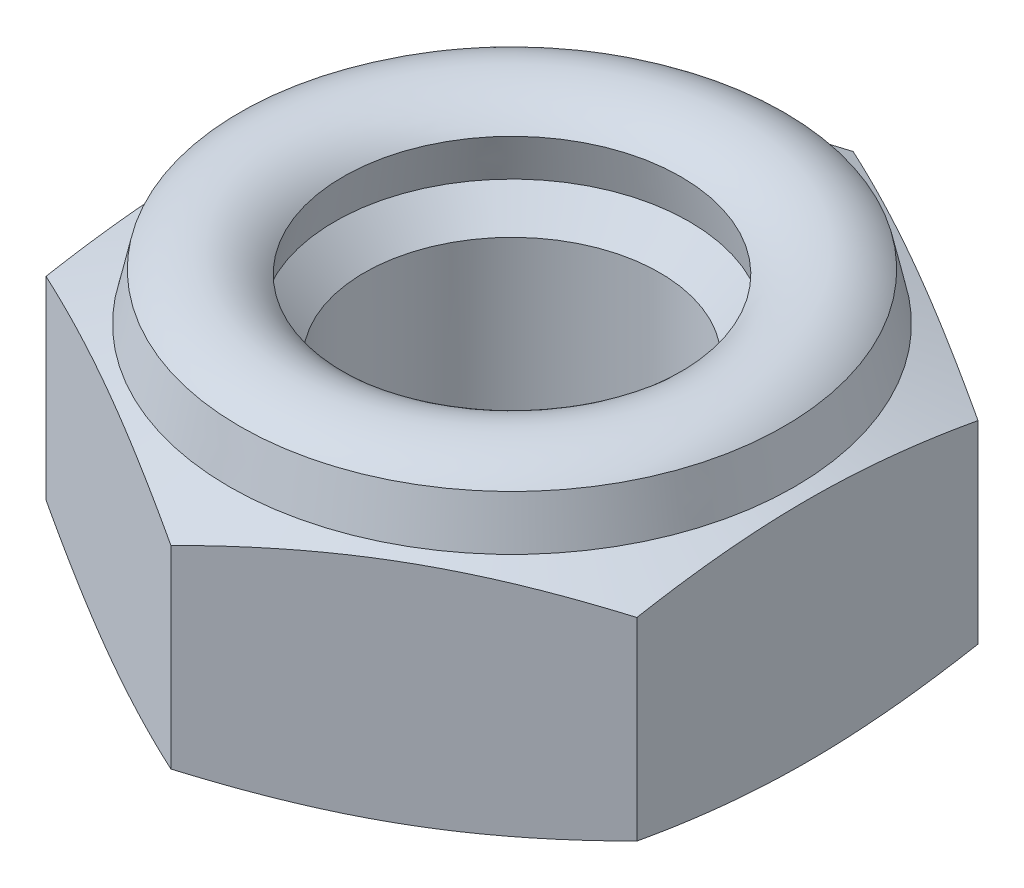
SolidWorks part; units mm, degrees
ref_plane "前视" through (0, 0, 0) normal (0, 0, 1) x (1, 0, 0)
ref_plane "上视" through (0, 0, 0) normal (0, 1, 0) x (1, 0, 0)
ref_plane "右视" through (0, 0, 0) normal (1, 0, 0) x (0, 0, -1)
sketch "草图1" plane through (0, 0, 0) normal (0, 1, 0) x (1, 0, 0)
  line L0 (0, 3.1049) -> (0, -3.4641) construction
  line L1 (0, -2.3094) -> (2, -1.1547)
  line L2 (2, -1.1547) -> (2, 1.1547)
  line L3 (2, 1.1547) -> (0, 2.3094)
  line L4 (0, 2.3094) -> (-2, 1.1547)
  line L5 (-2, 1.1547) -> (-2, -1.1547)
  line L6 (-2, -1.1547) -> (0, -2.3094)
  circle A0 centre (0, 0) radius 2 construction
  dimension "D1" = 4
extrude "拉伸1" add sketch "草图1" along normal blind 1.6
hole_wizard "M2 螺纹孔1" positions "草图3" profile "草图2" tap size "M2" standard "DIN"
sketch "草图3" plane through (0, 1.6, 0) normal (0, 1, 0) x (-1, 0, 0)
  point P0 (0, 0)
sketch "草图2" plane through (0, 1.6, 0) normal (1, 0, 0) x (0, 0, 1)
  line L0 (0, 0) -> (0, 6.4807)
  line L1 (0, 6.4807) -> (0.8, 6)
  line L2 (0.8, 6) -> (0.8, 4)
  line L3 (0.8, 4) -> (1, 4)
  line L4 (1, 4) -> (1, 0)
  line L5 (1, 0) -> (0, 0)
  line L10 (0, 6.4807) -> (-0.8, 6) construction
  line L11 (0, -6.35) -> (0, 107.95) construction
  dimension "蹟恇謂郰芛眻噤" = 1.6
  dimension "蹟恇謂郰芛旮僅" = 6
  dimension "蹟恇翋眻噤" = 2
  dimension "蹟恇旮僅" = 4
  dimension "絳芛褒僅" = 118
sketch "草图4" plane through (0, 0, 0) normal (1, 0, 0) x (0, 0, -1)
  line L0 (1.9124, 0) -> (2.3094, 0.1445)
  line L1 (0, 3.0267) -> (0, -1.2162) construction
  line L3 (2.3094, 1.6) -> (2.3094, 1.4555)
  line L4 (-2.3094, 0.8) -> (2.3094, 0.8) construction
  line L5 (-2.3094, 1.6) -> (-1.1547, 1.6) construction
  line L6 (1.9124, 0) -> (2.3094, 0)
  line L7 (1.9124, 1.6) -> (2.3094, 1.6)
  line L8 (1.9124, 1.6) -> (2.3094, 1.4555)
  line L9 (2.3094, 0) -> (2.3094, 0.1445)
  line L10 (-2.3094, 1.6) -> (-2.3094, 0) construction
  line L12 (2.3094, 1.6) -> (2.3094, 0) construction
  line L13 (1.1547, 1.6) -> (2.3094, 1.6) construction
  dimension "D1" = 20
revolve "切除-旋转2" cut sketch "草图4" angle 360 about L1
chamfer "倒角1" distance 0.2 angle 45 2 edges at (0, 1.6, 1) (0, 0, -1)
sketch "草图5" plane through (0, 0, 0) normal (0, 0, 1) x (1, 0, 0)
  line L0 (1.9124, 1.6) -> (-1.9124, 1.6) construction
  line L2 (1.9124, 1.6) -> (1.2, 1.6)
  line L3 (1.2, 1.6) -> (1.1434, 1.8908)
  line L4 (0, 0) -> (0, 2.2735) construction
  line L5 (1.9124, 1.6) -> (1.8417, 1.9188)
  arc A0 (1.1434, 1.8908) -> (1.8417, 1.9188) centre (1.5078, 1.524) cw
revolve "旋转1" add sketch "草图5" angle 360 about L4
